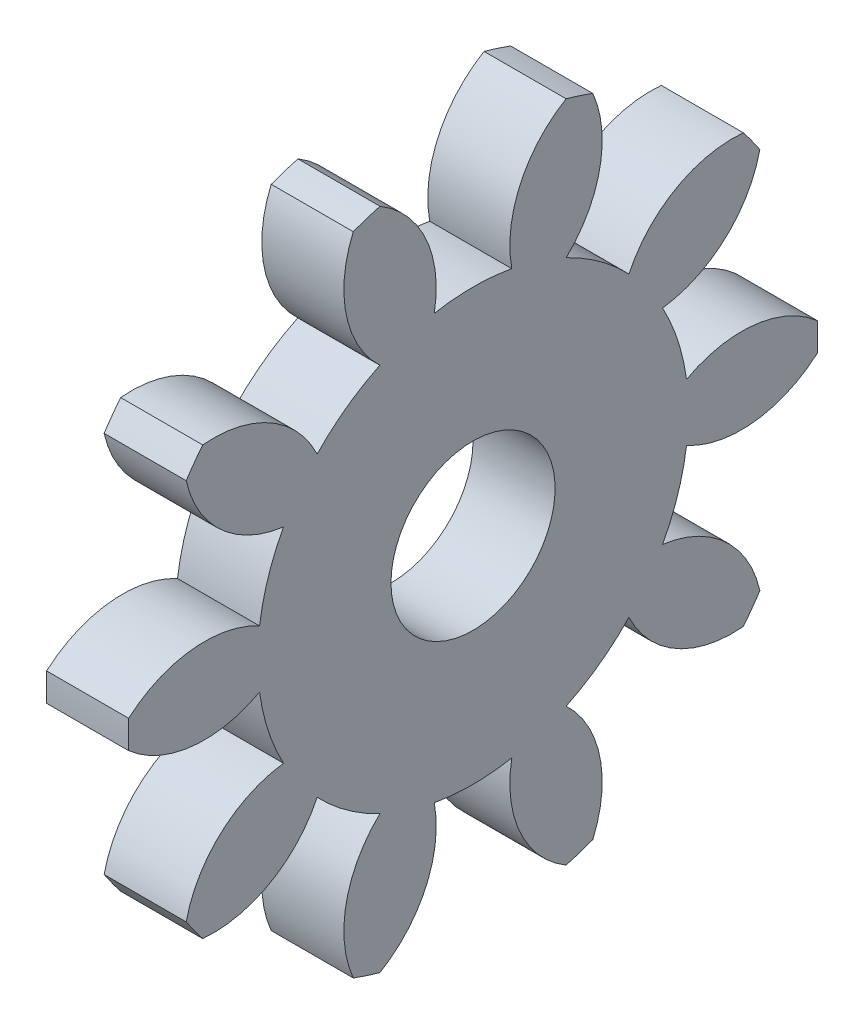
SolidWorks part; units mm, degrees
ref_plane "Plane1" through (0, 0, 0) normal (0, 0, 1) x (1, 0, 0)
ref_plane "Plane2" through (0, 0, 0) normal (0, 1, 0) x (1, 0, 0)
ref_plane "Plane3" through (0, 0, 0) normal (1, 0, 0) x (0, 0, -1)
sketch "HoldingSke" plane through (0, 0, 0) normal (0, 1, 0) x (1, 0, 0)
  line L0 (0, 0) -> (0.2814, -0.0496)
  line L1 (-15, 0) -> (100, 0) construction
  line L2 (0, 0) -> (-2.1039, 2.3779)
  line L3 (0, 0) -> (-11.863, 4.5341)
  line L4 (0, 0) -> (8.5048, 1.4996)
  line L5 (0, 0) -> (-46.8476, -17.4728)
  line L6 (0, 0) -> (-4.1448, -2.7965)
  line L7 (-2.1039, 2.3779) -> (8.6586, 51.2059)
  line L8 (-76.2, 54.61) -> (-74.4, 54.61)
  line L9 (-67.7845, 28.3722) -> (-49.3413, 33.142)
  line L10 (-76.2, 71.12) -> (104.1128, 71.12)
  line L11 (0, 0) -> (-5, 0)
  line L12 (-76.2, 101.6) -> (-76.083, 101.6)
  line L13 (24.9733, 27.94) -> (52.9518, 28.4284)
  line L14 (24.9733, 27.94) -> (24.9743, 27.94)
  line L15 (24.9733, 27.94) -> (100.4006, 29.5858)
  line L16 (-63.627, -3.5) -> (-12.827, -3.5)
  circle A0 centre (0, 0) radius 5
  circle A1 centre (0, 0) radius 13.124
  circle A2 centre (0, 0) radius 37.5
  circle A3 centre (0, 0) radius 5
  dimension "MHD" = 26.248
  dimension "Hub_dia" = 75
  dimension "Bore" = 10
  dimension "MBD" = 10
  dimension "Num_teeth" = 10
  dimension "Pitch_radius" = 180.3128
  dimension "Pitch" = 0.2857
  dimension "Width" = 5
  dimension "Overall_len" = 50
  dimension "Show_teeth" = 10
  dimension "Thickness" = 5
  dimension "OAL" = 50.0001
  dimension "T_dim" = 1.8
  dimension "Ap" = 14.5
  dimension "H" = 19.05
  dimension "Backlash" = 0.117
  dimension "Addendum_fac" = 1
  dimension "Dedendum_fac" = 1.25
  dimension "Clearance_fac" = 0.25
  dimension "Dedendum_add" = 0.001
  dimension "Module" = 3.5
sketch "BasProSke" plane through (0, 0, 0) normal (0, 1, 0) x (1, 0, 0)
  line L0 (-10, 0) -> (60, 0) construction
  line L1 (0, 0) -> (0, 21)
  line L2 (0, 0) -> (5, 0)
  line L3 (5, 0) -> (5, 21)
  line L4 (5, 21) -> (0, 21)
  dimension "Diameter" = 42
  dimension "Thickness" = 5
revolve "Base-Revolve" add sketch "BasProSke" angle 360 about L0
sketch "TooCutSke" plane through (0, 0, 0) normal (1, 0, 0) x (0, 0, -1)
  line L1 (0, 0) -> (0, 107) construction
  line L2 (0, 0) -> (-2.942, 17.2509) construction
  line L3 (0, 0) -> (-10.7017, 32.9365) construction
  line L4 (-2.942, 17.2509) -> (-5.3509, 16.4682) construction
  arc A0 (2.362, 12.9097) -> (-2.362, 12.9097) centre (0, 0) ccw
  arc A1 (5.7005, 20.2379) -> (-5.7005, 20.2379) centre (0, 0) ccw
  circle A2 centre (0, 0) radius 17.5 construction
  circle A3 centre (0, 0) radius 16.9426 construction
  arc A4 (-2.362, 12.9097) -> (-5.7005, 20.2379) centre (-9.242, 14.1999) ccw
  arc A5 (5.7005, 20.2379) -> (2.362, 12.9097) centre (9.242, 14.1999) ccw
  dimension "Root_dia" = 26.248
  dimension "Overcut_dia" = 42.0508
  dimension "Pitch_dia" = 35
  dimension "Base_dia" = 33.8852
  dimension "Flank_rad" = 7
  dimension "Half_ang" = 18
  dimension "Half_CT" = 2.5329
extrude "ToothCut" cut sketch "TooCutSke" along normal through all
fillet "Breaks" [suppressed] radius 0.07
fillet "RootFillets" [suppressed] radius 0.876
pattern_circular "TeethCuts" count 10 every 36 about axis through (-10, 0, 0) along (1, 0, 0) of "ToothCut", "RootFillets", "Breaks"
sketch "HubNeaOneSke" plane through (0, 0, 0) normal (-1, 0, 0) x (0, 0, 1)
  circle A0 centre (0, 0) radius 13.124
  dimension "Diameter" = 26.248
extrude "HubNearOne" [suppressed] add sketch "HubNeaOneSke" along normal blind 45.0001
sketch "HubNeaBotSke" plane through (0, 0, 0) normal (-1, 0, 0) x (0, 0, 1)
  circle A0 centre (0, 0) radius 13.124
  dimension "Diameter" = 26.248
extrude "HubNearBoth" [suppressed] add sketch "HubNeaBotSke" along normal blind 22.5
ref_plane "FarPln" through (5, 0, 0) normal (1, 0, 0) x (0, 0, -1)
sketch "HubFarSke" plane through (5, 0, 0) normal (1, 0, 0) x (0, 0, -1)
  circle A0 centre (0, 0) radius 13.124
  dimension "Diameter" = 26.248
extrude "HubFar" [suppressed] add sketch "HubFarSke" along normal blind 22.5
sketch "BorSke" plane through (0, 0, 0) normal (1, 0, 0) x (0, 0, -1)
  circle A0 centre (0, 0) radius 5
  dimension "Diameter" = 10
extrude "Bore" cut sketch "BorSke" along normal mid plane 100.0001
sketch "KeySke" plane through (0, 0, 0) normal (1, 0, 0) x (0, 0, -1)
  line L0 (-2, 0) -> (-2, 6.8)
  line L1 (-2, 6.8) -> (2, 6.8)
  line L2 (2, 6.8) -> (2, 0)
  line L3 (0, 0) -> (0, 34) construction
  line L4 (-2, 0) -> (2, 0)
  dimension "Offset" = 6.8
  dimension "Width" = 4
extrude "Keyway" [suppressed] cut sketch "KeySke" along normal mid plane 100.0001
pattern_circular "Keyway2" [suppressed] count 2 every 90 about axis through (-10, 0, 0) along (1, 0, 0)
equation "' \"Module@HoldingSke\" = 6.35"
equation "' \"Num_teeth@HoldingSke\" = 12"
equation "' \"Ap@HoldingSke\" =  20"
equation "' \"Width@HoldingSke\" = 0.5 * 25.4"
equation "' \"Hub_dia@HoldingSke\"= 1 * 25.4"
equation "' \"Overall_len@HoldingSke\" = 1.0 * 25.4"
equation "' \"Bore@HoldingSke\" = 0.75 * 25.4"
equation "' \"T_dim@HoldingSke\" = 0.1 * 25.4"
equation "' \"Width@KeySke\" = 0.25 * 25.4"
equation "' \"Show_teeth@HoldingSke\" = 13"
equation "' \"Backlash@HoldingSke\" = 0.009 * 25.4"
equation "' \"Addendum_fac@HoldingSke\" = 1.0"
equation "' \"Dedendum_fac@HoldingSke\" = 1.25"
equation "' \"Dedendum_add@HoldingSke\" = 0.00005 * 25.4"
equation "' \"Clearance_fac@HoldingSke\" = 0.25"
equation "\"Pitch@HoldingSke\" = 1 / \"Module@HoldingSke\""
equation "\"Overcut_dia@TooCutSke\" = (\"Num_teeth@HoldingSke\" + 2 * \"Addendum_fac@HoldingSke\") / \"Pitch@HoldingSke\" + 0.002 * 25.4"
equation "\"Pitch_dia@TooCutSke\" = \"Num_teeth@HoldingSke\" / \"Pitch@HoldingSke\""
equation "\"Base_dia@TooCutSke\" = \"Num_teeth@HoldingSke\" / \"Pitch@HoldingSke\" * cos((\"Ap@HoldingSke\"  * 3.14159265 / 180))"
equation "\"Root_dia@TooCutSke\" = (\"Num_teeth@HoldingSke\" + 2) / \"Pitch@HoldingSke\" - 2 * (\"Addendum_fac@HoldingSke\" + \"Dedendum_fac@HoldingSke\") / \"Pitch@HoldingSke\" - \"Dedendum_add@HoldingSke\" * 2"
equation "\"Half_ang@TooCutSke\" = 180 / \"Num_teeth@HoldingSke\""
equation "\"Half_CT@TooCutSke\" = \"Num_teeth@HoldingSke\" / \"Pitch@HoldingSke\" * sin((3.14159265 / 2 / \"Num_teeth@HoldingSke\")) / 2 - 7 * \"Backlash@HoldingSke\" / 4"
equation "\"Flank_rad@TooCutSke\" = \"Num_teeth@HoldingSke\" / \"Pitch@HoldingSke\" / 5"
equation "\"Radius@RootFillets\" = \"Clearance_fac@HoldingSke\" / \"Pitch@HoldingSke\" + \"Dedendum_add@HoldingSke\""
equation "\"Break_rad@Breaks\" = 0.02 / \"Pitch@HoldingSke\""
equation "\"Thickness@HoldingSke\" = \"Width@HoldingSke\""
equation "\"OAL@HoldingSke\" = \"Thickness@HoldingSke\""
equation "\"MHD@HoldingSke\" = (\"Num_teeth@HoldingSke\" + 2) / \"Pitch@HoldingSke\" - 2 * (\"Addendum_fac@HoldingSke\" + \"Dedendum_fac@HoldingSke\")  / \"Pitch@HoldingSke\" - \"Dedendum_add@HoldingSke\" * 2"
equation "\"MBD@HoldingSke\" = (\"Num_teeth@HoldingSke\" + 2) / \"Pitch@HoldingSke\" - 2 * (\"Addendum_fac@HoldingSke\" + \"Dedendum_fac@HoldingSke\")  / \"Pitch@HoldingSke\" - \"Dedendum_add@HoldingSke\" * 2 - 0.002 * 25.4"
equation "\"MHD@HoldingSke\" = ((sgn( \"MHD@HoldingSke\" - \"Hub_dia@HoldingSke\" )-1)*( \"MHD@HoldingSke\" - \"Hub_dia@HoldingSke\" ))/-2+ \"Hub_dia@HoldingSke\""
equation "\"MBD@HoldingSke\" = ((sgn( \"MBD@HoldingSke\" - \"Bore@HoldingSke\" )-1)*( \"MBD@HoldingSke\" - \"Bore@HoldingSke\" ))/-2+ \"Bore@HoldingSke\""
equation "\"OAL@HoldingSke\" = ((sgn( \"OAL@HoldingSke\" - \"Overall_len@HoldingSke\" )+1)*( \"OAL@HoldingSke\" - \"Overall_len@HoldingSke\" ))/2 + \"Overall_len@HoldingSke\" + 0.000002 * 25.4"
equation "\"Num_teeth@TeethCuts\" = int( \"Show_teeth@HoldingSke\" ) + 1"
equation "\"Num_teeth@TeethCuts\" = ((sgn( \"Num_teeth@TeethCuts\" - \"Num_teeth@HoldingSke\" )-1)*( \"Num_teeth@TeethCuts\" - \"Num_teeth@HoldingSke\" ))/-2+ \"Num_teeth@HoldingSke\""
equation "\"Num_teeth@TeethCuts\" = ((sgn( \"Num_teeth@TeethCuts\" - 2.0)+1)*( \"Num_teeth@TeethCuts\" - 2.0))/2 +2.0"
equation "\"Angle@TeethCuts\" = 360.0 / \"Num_teeth@HoldingSke\""
equation "\"Diameter@BasProSke\" = (\"Num_teeth@HoldingSke\" + 2 * \"Addendum_fac@HoldingSke\") / \"Pitch@HoldingSke\""
equation "\"Thickness@BasProSke\"  = \"Thickness@HoldingSke\""
equation "' \"Fillet_rad@BasProSke\" =  \"Thickness@HoldingSke\" * 0.05"
equation "\"MHD@HoldingSke\" = ((sgn( \"MHD@HoldingSke\" - \"Root_dia@TooCutSke\" )-1)*( \"MHD@HoldingSke\" - \"Root_dia@TooCutSke\" ))/-2+ \"Root_dia@TooCutSke\""
equation "\"Diameter@HubNeaOneSke\" = \"MHD@HoldingSke\""
equation "\"Length@HubNearOne\" = \"OAL@HoldingSke\" - \"Thickness@BasProSke\""
equation "\"Diameter@HubNeaBotSke\" = \"MHD@HoldingSke\""
equation "\"Length@HubNearBoth\" = ( \"OAL@HoldingSke\" - \"Thickness@BasProSke\" ) / 2.0"
equation "\"Thickness@FarPln\" = \"Thickness@BasProSke\""
equation "\"Diameter@HubFarSke\" = \"MHD@HoldingSke\""
equation "\"Length@HubFar\" = ( \"OAL@HoldingSke\" - \"Thickness@BasProSke\" ) / 2.0"
equation "\"Diameter@BorSke\" = \"MBD@HoldingSke\""
equation "\"D1@Bore\" = \"OAL@HoldingSke\" * 2.0"
equation "\"D1@Keyway\" = \"OAL@HoldingSke\" * 2.0"
equation "\"Offset@KeySke\" = \"T_dim@HoldingSke\" + \"MBD@HoldingSke\" / 2.0"
